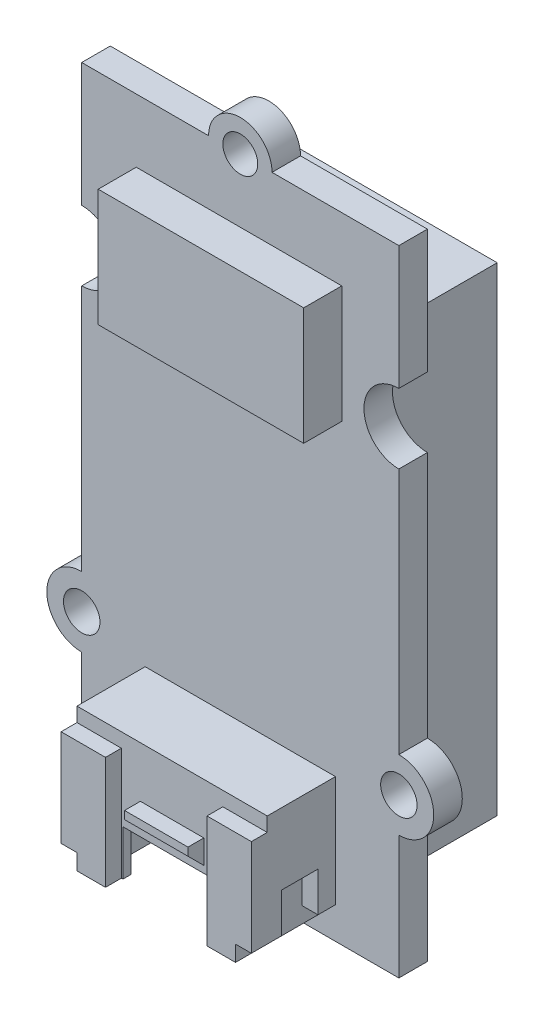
SolidWorks part; units mm, degrees
ref_plane "Plan de face" through (0, 0, 0) normal (0, 0, 1) x (1, 0, 0)
ref_plane "Plan de dessus" through (0, 0, 0) normal (0, 1, 0) x (1, 0, 0)
ref_plane "Plan de droite" through (0, 0, 0) normal (1, 0, 0) x (0, 0, -1)
sketch "Esquisse1" plane through (0, 0, 0) normal (0, 0, 1) x (1, 0, 0)
  line L0 (-2.7446, 10.9929) -> (-2.7446, -9.0071) construction
  line L2 (-12.7446, 10.9929) -> (-12.7446, 3.1929)
  line L3 (-12.7446, -9.0071) -> (-4.9946, -9.0071)
  line L4 (7.2554, 10.9929) -> (7.2554, 3.1929)
  line L5 (-12.7446, 0.9929) -> (7.2554, 0.9929) construction
  line L7 (-0.4946, -9.0071) -> (7.2554, -9.0071)
  line L8 (-12.7446, -1.2071) -> (-12.7446, -9.0071)
  line L9 (7.2554, -1.2071) -> (7.2554, -9.0071)
  line L10 (-12.7446, 10.9929) -> (-12.7446, 18.7929)
  line L11 (7.2554, 10.9929) -> (7.2554, 18.7929)
  line L12 (-12.7446, 30.9929) -> (-4.7446, 30.9929)
  line L13 (-12.7446, 20.9929) -> (7.2554, 20.9929) construction
  line L14 (-12.7446, 23.1929) -> (-12.7446, 30.9929)
  line L15 (-0.7446, 30.9929) -> (7.2554, 30.9929)
  line L16 (7.2554, 23.1929) -> (7.2554, 30.9929)
  arc A1 (-0.4946, -9.0071) -> (-4.9946, -9.0071) centre (-2.7446, -9.0071) ccw
  arc A2 (-12.7446, 3.1929) -> (-12.7446, -1.2071) centre (-12.7446, 0.9929) ccw
  arc A3 (7.2554, -1.2071) -> (7.2554, 3.1929) centre (7.2554, 0.9929) ccw
  circle A4 centre (-12.7446, 0.9929) radius 1.15
  circle A5 centre (7.2554, 0.9929) radius 1.15
  arc A6 (-12.7446, 18.7929) -> (-12.7446, 23.1929) centre (-12.7446, 20.9929) ccw
  arc A7 (7.2554, 23.1929) -> (7.2554, 18.7929) centre (7.2554, 20.9929) ccw
  arc A8 (-0.7446, 30.9929) -> (-4.7446, 30.9929) centre (-2.7446, 30.9929) ccw
  circle A9 centre (-2.7446, 30.9929) radius 1.1
  dimension "D3" = 10
  dimension "D1" = 20
  dimension "D2" = 20
  dimension "D4" = 40
  dimension "D5" = 10
extrude "Boss.-Extru.1" add sketch "Esquisse1" along normal blind 1.8
sketch "Esquisse2" plane through (0, 0, 1.8) normal (0, 0, 1) x (1, 0, 0)
  line L0 (-12.7446, -1.2071) -> (-12.7446, -9.0071) construction
  line L1 (-8.7446, -0.0071) -> (3.2554, -0.0071)
  line L2 (-8.7446, -0.0071) -> (-8.7446, -8.0071)
  line L3 (-8.7446, -8.0071) -> (3.2554, -8.0071)
  line L4 (3.2554, -0.0071) -> (3.2554, -8.0071)
  line L5 (-12.7446, -9.0071) -> (-4.9946, -9.0071) construction
  dimension "D1" = 8
  dimension "D2" = 12
  dimension "D3" = 4
  dimension "D4" = 1
extrude "Boss.-Extru.2" add sketch "Esquisse2" along normal blind 5.3
sketch "Esquisse3" plane through (0, 0, 7.1) normal (0, 0, 1) x (1, 0, 0)
  line L0 (-8.7446, -0.0071) -> (3.2554, -0.0071)
  line L1 (3.2554, -0.0071) -> (3.2554, -0.9071)
  line L2 (3.2554, -8.0071) -> (3.2554, -0.0071) construction
  line L3 (3.2554, -0.9071) -> (0.4554, -0.9071)
  line L4 (0.4554, -0.9071) -> (0.4554, -8.0071)
  line L5 (-8.7446, -8.0071) -> (3.2554, -8.0071) construction
  line L6 (-8.7446, -0.0071) -> (-8.7446, -0.9071)
  line L7 (-8.7446, -0.0071) -> (-8.7446, -8.0071) construction
  line L8 (-8.7446, -0.9071) -> (-5.9446, -0.9071)
  line L9 (-5.9446, -0.9071) -> (-5.9446, -8.0071)
  line L10 (-5.9446, -8.0071) -> (0.4554, -8.0071)
  line L11 (-2.7446, -0.0071) -> (-2.7446, -10.5035) construction
  line L12 (-4.7446, -3.2071) -> (-0.7446, -3.2071)
  line L13 (-4.7446, -3.2071) -> (-4.7446, -4.7071)
  line L14 (-4.7446, -4.7071) -> (-0.7446, -4.7071)
  line L15 (-0.7446, -3.2071) -> (-0.7446, -4.7071)
  dimension "D1" = 1.5
  dimension "D2" = 4
  dimension "D3" = 2
  dimension "D4" = 3.3
extrude "Enlèv. mat.-Extru.1" cut sketch "Esquisse3" against normal blind 1
chamfer "Chanfrein1" distance 1 angle 45 1 edges at (-2.7446, -4.7071, 7.1)
sketch "Esquisse4" plane through (0, 0, 6.1) normal (0, 0, 1) x (1, 0, 0)
  line L0 (-5.9446, -8.0071) -> (0.4554, -8.0071) construction
  line L1 (-5.8446, -8.0071) -> (0.3554, -8.0071)
  line L2 (-5.8446, -8.0071) -> (-5.8446, -5.1455)
  line L3 (-5.8446, -5.1455) -> (0.3554, -5.1455)
  line L4 (0.3554, -8.0071) -> (0.3554, -5.1455)
  line L5 (-2.7446, -4.7071) -> (-2.7446, -9.3222) construction
  line L6 (-4.7446, -4.7071) -> (-0.7446, -4.7071) construction
  dimension "D1" = 6.2
  dimension "D2" = 3.1
extrude "Enlèv. mat.-Extru.2" cut sketch "Esquisse4" against normal blind 1
sketch "Esquisse5" plane through (0, 0, 7.1) normal (0, 0, 1) x (1, 0, 0)
  line L1 (-8.7446, -8.0071) -> (-7.7446, -8.0071)
  line L2 (-8.7446, -8.0071) -> (-8.7446, -7.0071)
  line L3 (-8.7446, -7.0071) -> (-7.7446, -7.0071)
  line L4 (-7.7446, -8.0071) -> (-7.7446, -7.0071)
  line L5 (3.2554, -8.0071) -> (2.2554, -8.0071)
  line L6 (3.2554, -8.0071) -> (3.2554, -7.0071)
  line L7 (3.2554, -7.0071) -> (2.2554, -7.0071)
  line L8 (2.2554, -8.0071) -> (2.2554, -7.0071)
  dimension "D1" = 1
  dimension "D2" = 1
  dimension "D3" = 1
extrude "Enlèv. mat.-Extru.3" cut sketch "Esquisse5" against normal up to surface (5.3 mm away)
sketch "Esquisse6" plane through (0, -8.0071, 0) normal (0, -1, 0) x (1, 0, 0)
  line L0 (-8.7446, 1.8) -> (-8.7446, 7.1) construction
  line L1 (-8.7446, 5.2) -> (-7.7446, 5.2)
  line L2 (-8.7446, 5.2) -> (-8.7446, 2.9)
  line L3 (-8.7446, 2.9) -> (-7.7446, 2.9)
  line L4 (-7.7446, 5.2) -> (-7.7446, 2.9)
  line L5 (-7.7446, 1.8) -> (-7.7446, 7.1) construction
  line L6 (-7.7446, 7.1) -> (-8.7446, 7.1) construction
  line L7 (2.2554, 1.8) -> (2.2554, 7.1) construction
  line L8 (2.2554, 5.2) -> (3.2554, 5.2)
  line L9 (2.2554, 5.2) -> (2.2554, 2.9)
  line L10 (2.2554, 2.9) -> (3.2554, 2.9)
  line L11 (3.2554, 5.2) -> (3.2554, 2.9)
  line L12 (3.2554, 1.8) -> (3.2554, 7.1) construction
  dimension "D1" = 1.9
  dimension "D2" = 2.3
extrude "Enlèv. mat.-Extru.4" cut sketch "Esquisse6" against normal blind 3.5
sketch "Esquisse7" plane through (0, -8.0071, 0) normal (0, -1, 0) x (1, 0, 0)
  line L0 (-8.7446, 5.2) -> (-8.7446, 2.9) construction
  line L1 (-6.1446, 5.6) -> (0.6554, 5.6)
  line L2 (-6.9446, 5.6) -> (-6.9446, 2.6)
  line L3 (-6.9446, 2.6) -> (1.4554, 2.6)
  line L4 (1.4554, 5.6) -> (1.4554, 2.6)
  line L5 (3.2554, 2.9) -> (3.2554, 5.2) construction
  line L6 (-0.7291, 1.8) -> (2.2554, 1.8) construction
  line L7 (-6.9446, 5.6) -> (-6.9446, 6.4)
  line L8 (-6.9446, 6.4) -> (-6.1446, 6.4)
  line L9 (-6.1446, 6.4) -> (-6.1446, 5.6)
  line L10 (1.4554, 5.6) -> (1.4554, 6.4)
  line L11 (1.4554, 6.4) -> (0.6554, 6.4)
  line L12 (0.6554, 6.4) -> (0.6554, 5.6)
  dimension "D1" = 1.8
  dimension "D2" = 1.8
  dimension "D3" = 0.8
  dimension "D4" = 3
extrude "Enlèv. mat.-Extru.5" cut sketch "Esquisse7" against normal blind 7
sketch "Esquisse8" plane through (0, 0, 2.6) normal (0, 0, 1) x (1, 0, 0)
  line L0 (-7.7446, -8.0071) -> (-4.7602, -8.0071) construction
  line L1 (-5.7944, -8.0071) -> (0.3554, -8.0071)
  line L2 (-5.7944, -8.0071) -> (-5.7944, -6.7071)
  line L3 (-5.7944, -6.7071) -> (0.3554, -6.7071)
  line L4 (0.3554, -8.0071) -> (0.3554, -6.7071)
  line L5 (0.3554, -8.0071) -> (0.3554, -5.1455) construction
  dimension "D1" = 1.3
extrude "Enlèv. mat.-Extru.6" cut sketch "Esquisse8" against normal up to surface (0.8 mm away)
sketch "Esquisse16" plane through (0, 0, 1.8) normal (0, 0, 1) x (1, 0, 0)
  line L0 (-4.7446, 30.9929) -> (-12.7446, 30.9929) construction
  line L1 (-9.3046, 26.9929) -> (3.6554, 26.9929)
  line L2 (-9.3046, 26.9929) -> (-9.3046, 19.5929)
  line L3 (-9.3046, 19.5929) -> (3.6554, 19.5929)
  line L4 (3.6554, 26.9929) -> (3.6554, 19.5929)
  line L5 (7.2554, 23.1929) -> (7.2554, 30.9929) construction
  dimension "D1" = 12.96
  dimension "D2" = 7.4
  dimension "D3" = 4
  dimension "D4" = 3.6
extrude "Boss.-Extru.9" add sketch "Esquisse16" along normal blind 2.4
sketch "Esquisse17" plane through (0, 0, 0) normal (0, 0, -1) x (-1, 0, 0)
  line L0 (-7.2554, 3.1929) -> (-7.2554, 18.7929) construction
  line L1 (-4.2554, 23.9571) -> (9.7446, 23.9571)
  line L2 (-4.2554, 23.9571) -> (-4.2554, -6.2429)
  line L3 (-4.2554, -6.2429) -> (9.7446, -6.2429)
  line L4 (9.7446, 23.9571) -> (9.7446, -6.2429)
  dimension "D1" = 30.2
  dimension "D2" = 14
  dimension "D3" = 3
extrude "Boss.-Extru.10" add sketch "Esquisse17" along normal blind 7.4
sketch "Esquisse18" plane through (0, 0, -7.4) normal (0, 0, -1) x (-1, 0, 0)
  line L0 (-4.2554, -6.2429) -> (9.7446, -6.2429) construction
  line L1 (-1.5054, 0.2571) -> (2.6135, 0.2571)
  line L2 (-2.0054, -0.2429) -> (-2.0054, -4.2429)
  line L3 (-1.5054, -4.7429) -> (2.5761, -4.7429)
  line L4 (7.4946, -0.2429) -> (7.4946, -4.2429)
  line L5 (-4.2554, 23.9571) -> (-4.2554, -6.2429) construction
  line L6 (-0.8107, -0.7429) -> (2.0921, -0.7429)
  line L7 (6.4946, -0.9375) -> (6.4946, -3.5482)
  line L8 (-0.8107, -3.7429) -> (2.0921, -3.7429)
  line L9 (-1.0054, -0.9375) -> (-1.0054, -3.5482)
  line L10 (-0.8107, -0.7429) -> (-1.658, 0.1045)
  line L11 (2.2446, -0.7429) -> (2.2446, -3.7429) construction
  line L12 (2.2446, -0.7429) -> (2.2446, -3.7429)
  line L13 (3.2446, -0.7429) -> (3.2446, -3.7429)
  line L14 (-2.0054, 0.2571) -> (7.4946, 0.2571) construction
  line L15 (-2.0054, 0.2571) -> (-2.0054, -4.7429) construction
  line L16 (-2.0054, -0.2429) -> (-1.8527, -0.0902)
  line L17 (-2.0054, -4.7429) -> (7.4946, -4.7429) construction
  line L18 (-2.0054, -4.2429) -> (-1.8527, -4.3955)
  line L19 (7.4946, 0.2571) -> (7.4946, -4.7429) construction
  line L20 (6.9946, 0.2571) -> (7.1473, 0.1045)
  line L21 (6.9946, -4.7429) -> (7.1473, -4.5902)
  line L22 (3.3655, -0.7429) -> (6.3, -0.7429)
  line L23 (3.3655, -3.7429) -> (6.3, -3.7429)
  line L24 (-1.0054, -0.7429) -> (6.4946, -0.7429) construction
  line L25 (-1.0054, -0.9375) -> (-1.8527, -0.0902)
  line L26 (-1.0054, -3.7429) -> (6.4946, -3.7429) construction
  line L27 (-0.8107, -3.7429) -> (-1.658, -4.5902)
  line L28 (-1.0054, -3.5482) -> (-1.8527, -4.3955)
  line L29 (6.4946, -0.9375) -> (7.342, -0.0902)
  line L30 (6.3, -0.7429) -> (7.1473, 0.1045)
  line L31 (6.4946, -3.5482) -> (7.342, -4.3955)
  line L32 (6.3, -3.7429) -> (7.1473, -4.5902)
  line L33 (2.8815, 0.2571) -> (6.9946, 0.2571)
  line L34 (-1.5054, 7.2571) -> (2.6135, 7.2571)
  line L35 (7.342, -4.3955) -> (7.4946, -4.2429)
  line L36 (7.342, -0.0902) -> (7.4946, -0.2429)
  line L37 (6.4946, -0.7429) -> (6.4946, -3.7429) construction
  line L38 (-2.0054, 6.7571) -> (-2.0054, 2.7571)
  line L39 (-1.5054, 2.2571) -> (2.5761, 2.2571)
  line L40 (7.4946, 6.7571) -> (7.4946, 2.7571)
  line L41 (2.2446, -0.7429) -> (2.7446, -0.2429)
  line L42 (2.7446, -0.2429) -> (3.2446, -0.7429)
  line L43 (2.2446, -3.7429) -> (2.7446, -4.0692)
  line L44 (2.7446, -4.0692) -> (3.2446, -3.7429)
  line L45 (2.0921, -0.7429) -> (2.6135, 0.2571)
  line L46 (3.3655, -0.7429) -> (2.8815, 0.2571)
  line L47 (2.0921, -3.7429) -> (2.5761, -4.7429)
  line L48 (3.3655, -3.7429) -> (2.8441, -4.7429)
  line L49 (-1.658, 0.1045) -> (-1.5054, 0.2571)
  line L50 (-1.0054, -0.7429) -> (-1.0054, -3.7429) construction
  line L51 (-1.658, -4.5902) -> (-1.5054, -4.7429)
  line L52 (2.8441, -4.7429) -> (6.9946, -4.7429)
  line L53 (-0.8107, 6.2571) -> (2.0921, 6.2571)
  line L54 (6.4946, 6.0625) -> (6.4946, 3.4518)
  line L55 (-0.8107, 3.2571) -> (2.0921, 3.2571)
  line L56 (-1.0054, 6.0625) -> (-1.0054, 3.4518)
  line L57 (-0.8107, 6.2571) -> (-1.658, 7.1045)
  line L58 (2.2446, 6.2571) -> (2.2446, 3.2571)
  line L59 (3.2446, 6.2571) -> (3.2446, 3.2571)
  line L60 (-2.0054, 6.7571) -> (-1.8527, 6.9098)
  line L61 (-2.0054, 2.7571) -> (-1.8527, 2.6045)
  line L62 (6.9946, 7.2571) -> (7.1473, 7.1045)
  line L63 (6.9946, 2.2571) -> (7.1473, 2.4098)
  line L64 (3.3655, 6.2571) -> (6.3, 6.2571)
  line L65 (3.3655, 3.2571) -> (6.3, 3.2571)
  line L66 (-1.0054, 6.0625) -> (-1.8527, 6.9098)
  line L67 (-0.8107, 3.2571) -> (-1.658, 2.4098)
  line L68 (-1.0054, 3.4518) -> (-1.8527, 2.6045)
  line L69 (6.4946, 6.0625) -> (7.342, 6.9098)
  line L70 (6.3, 6.2571) -> (7.1473, 7.1045)
  line L71 (6.4946, 3.4518) -> (7.342, 2.6045)
  line L72 (6.3, 3.2571) -> (7.1473, 2.4098)
  line L73 (2.8815, 7.2571) -> (6.9946, 7.2571)
  line L74 (7.342, 2.6045) -> (7.4946, 2.7571)
  line L75 (7.342, 6.9098) -> (7.4946, 6.7571)
  line L76 (2.2446, 6.2571) -> (2.7446, 6.7571)
  line L77 (2.7446, 6.7571) -> (3.2446, 6.2571)
  line L78 (2.2446, 3.2571) -> (2.7446, 2.9308)
  line L79 (2.7446, 2.9308) -> (3.2446, 3.2571)
  line L80 (2.0921, 6.2571) -> (2.6135, 7.2571)
  line L81 (3.3655, 6.2571) -> (2.8815, 7.2571)
  line L82 (2.0921, 3.2571) -> (2.5761, 2.2571)
  line L83 (3.3655, 3.2571) -> (2.8441, 2.2571)
  line L84 (-1.658, 7.1045) -> (-1.5054, 7.2571)
  line L85 (-1.658, 2.4098) -> (-1.5054, 2.2571)
  line L86 (2.8441, 2.2571) -> (6.9946, 2.2571)
  line L87 (2.2446, 6.2571) -> (2.2446, 3.2571) construction
  line L88 (-1.5054, 14.2571) -> (2.6135, 14.2571)
  line L89 (-2.0054, 13.7571) -> (-2.0054, 9.7571)
  line L90 (-1.5054, 9.2571) -> (2.5761, 9.2571)
  line L91 (7.4946, 13.7571) -> (7.4946, 9.7571)
  line L92 (-0.8107, 13.2571) -> (2.0921, 13.2571)
  line L93 (6.4946, 13.0625) -> (6.4946, 10.4518)
  line L94 (-0.8107, 10.2571) -> (2.0921, 10.2571)
  line L95 (-1.0054, 13.0625) -> (-1.0054, 10.4518)
  line L96 (-0.8107, 13.2571) -> (-1.658, 14.1045)
  line L97 (2.2446, 13.2571) -> (2.2446, 10.2571)
  line L98 (3.2446, 13.2571) -> (3.2446, 10.2571)
  line L99 (-2.0054, 13.7571) -> (-1.8527, 13.9098)
  line L100 (-2.0054, 9.7571) -> (-1.8527, 9.6045)
  line L101 (6.9946, 14.2571) -> (7.1473, 14.1045)
  line L102 (6.9946, 9.2571) -> (7.1473, 9.4098)
  line L103 (3.3655, 13.2571) -> (6.3, 13.2571)
  line L104 (3.3655, 10.2571) -> (6.3, 10.2571)
  line L105 (-1.0054, 13.0625) -> (-1.8527, 13.9098)
  line L106 (-0.8107, 10.2571) -> (-1.658, 9.4098)
  line L107 (-1.0054, 10.4518) -> (-1.8527, 9.6045)
  line L108 (6.4946, 13.0625) -> (7.342, 13.9098)
  line L109 (6.3, 13.2571) -> (7.1473, 14.1045)
  line L110 (6.4946, 10.4518) -> (7.342, 9.6045)
  line L111 (6.3, 10.2571) -> (7.1473, 9.4098)
  line L112 (2.8815, 14.2571) -> (6.9946, 14.2571)
  line L113 (7.342, 9.6045) -> (7.4946, 9.7571)
  line L114 (7.342, 13.9098) -> (7.4946, 13.7571)
  line L115 (2.2446, 13.2571) -> (2.7446, 13.7571)
  line L116 (2.7446, 13.7571) -> (3.2446, 13.2571)
  line L117 (2.2446, 10.2571) -> (2.7446, 9.9308)
  line L118 (2.7446, 9.9308) -> (3.2446, 10.2571)
  line L119 (2.0921, 13.2571) -> (2.6135, 14.2571)
  line L120 (3.3655, 13.2571) -> (2.8815, 14.2571)
  line L121 (2.0921, 10.2571) -> (2.5761, 9.2571)
  line L122 (3.3655, 10.2571) -> (2.8441, 9.2571)
  line L123 (-1.658, 14.1045) -> (-1.5054, 14.2571)
  line L124 (-1.658, 9.4098) -> (-1.5054, 9.2571)
  line L125 (2.8441, 9.2571) -> (6.9946, 9.2571)
  line L126 (2.2446, 13.2571) -> (2.2446, 10.2571) construction
  line L127 (-1.5054, 21.2571) -> (2.6135, 21.2571)
  line L128 (-2.0054, 20.7571) -> (-2.0054, 16.7571)
  line L129 (-1.5054, 16.2571) -> (2.5761, 16.2571)
  line L130 (7.4946, 20.7571) -> (7.4946, 16.7571)
  line L131 (-0.8107, 20.2571) -> (2.0921, 20.2571)
  line L132 (6.4946, 20.0625) -> (6.4946, 17.4518)
  line L133 (-0.8107, 17.2571) -> (2.0921, 17.2571)
  line L134 (-1.0054, 20.0625) -> (-1.0054, 17.4518)
  line L135 (-0.8107, 20.2571) -> (-1.658, 21.1045)
  line L136 (2.2446, 20.2571) -> (2.2446, 17.2571)
  line L137 (3.2446, 20.2571) -> (3.2446, 17.2571)
  line L138 (-2.0054, 20.7571) -> (-1.8527, 20.9098)
  line L139 (-2.0054, 16.7571) -> (-1.8527, 16.6045)
  line L140 (6.9946, 21.2571) -> (7.1473, 21.1045)
  line L141 (6.9946, 16.2571) -> (7.1473, 16.4098)
  line L142 (3.3655, 20.2571) -> (6.3, 20.2571)
  line L143 (3.3655, 17.2571) -> (6.3, 17.2571)
  line L144 (-1.0054, 20.0625) -> (-1.8527, 20.9098)
  line L145 (-0.8107, 17.2571) -> (-1.658, 16.4098)
  line L146 (-1.0054, 17.4518) -> (-1.8527, 16.6045)
  line L147 (6.4946, 20.0625) -> (7.342, 20.9098)
  line L148 (6.3, 20.2571) -> (7.1473, 21.1045)
  line L149 (6.4946, 17.4518) -> (7.342, 16.6045)
  line L150 (6.3, 17.2571) -> (7.1473, 16.4098)
  line L151 (2.8815, 21.2571) -> (6.9946, 21.2571)
  line L152 (7.342, 16.6045) -> (7.4946, 16.7571)
  line L153 (7.342, 20.9098) -> (7.4946, 20.7571)
  line L154 (2.2446, 20.2571) -> (2.7446, 20.7571)
  line L155 (2.7446, 20.7571) -> (3.2446, 20.2571)
  line L156 (2.2446, 17.2571) -> (2.7446, 16.9308)
  line L157 (2.7446, 16.9308) -> (3.2446, 17.2571)
  line L158 (2.0921, 20.2571) -> (2.6135, 21.2571)
  line L159 (3.3655, 20.2571) -> (2.8815, 21.2571)
  line L160 (2.0921, 17.2571) -> (2.5761, 16.2571)
  line L161 (3.3655, 17.2571) -> (2.8441, 16.2571)
  line L162 (-1.658, 21.1045) -> (-1.5054, 21.2571)
  line L163 (-1.658, 16.4098) -> (-1.5054, 16.2571)
  line L164 (2.8441, 16.2571) -> (6.9946, 16.2571)
  line L165 (2.2446, 20.2571) -> (2.2446, 17.2571) construction
  line L166 (-1.5054, 0.2571) -> (-1.5054, 7.2571) construction
  line L167 (0.5354, 9.2571) -> (0.5541, 7.2571) construction
  line L168 (4.9194, 9.2571) -> (4.9381, 7.2571) construction
  circle A0 centre (0.5447, 8.2571) radius 0.5
  circle A1 centre (4.9287, 8.2571) radius 0.5
  dimension "D1" = 4
  dimension "D2" = 7
  dimension "D3" = 1.5
  dimension "D4" = 2.25
  dimension "D5" = 1
extrude "Enlèv. mat.-Extru.8" cut sketch "Esquisse18" against normal blind 0.1
